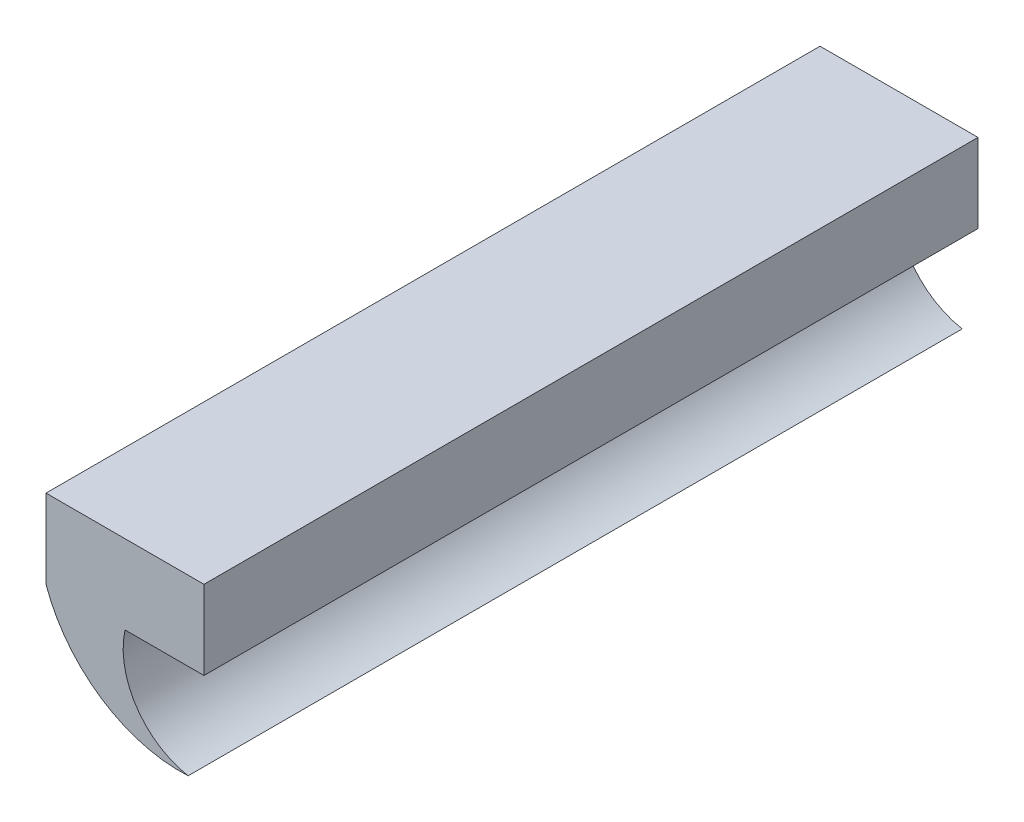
SolidWorks part; units mm, degrees
ref_plane "前视基准面" through (0, 0, 0) normal (0, 0, 1) x (1, 0, 0)
ref_plane "上视基准面" through (0, 0, 0) normal (0, 1, 0) x (1, 0, 0)
ref_plane "右视基准面" through (0, 0, 0) normal (1, 0, 0) x (0, 0, -1)
other "Configuration Table"
sketch "草图1" plane through (0, 0, 0) normal (0, 0, 1) x (1, 0, 0)
  line L1 (0, 1) -> (2, 1)
  line L2 (0, 1) -> (0, 0)
  line L3 (0, 0) -> (2, 0)
  line L4 (2, 1) -> (2, 0)
  dimension "D1" = 1
  dimension "D2" = 2
extrude "凸台-拉伸1" add sketch "草图1" along normal blind 9.8
sketch "草图2" plane through (0, 0, 0) normal (0, 0, -1) x (-1, 0, 0)
  line L13 (0, 0) -> (-2, 0) construction
  line L14 (0, 0) -> (-1, 0)
  line L15 (-2, 0) -> (-2, 1) construction
  arc A0 (0, 0) -> (-1.8, -1.2) centre (-1.6981, 0.5971) cw
  arc A1 (-1.8, -1.2) -> (-1, 0) centre (-1.9765, -0.2157) ccw
  dimension "D1" = 1.8
  dimension "D2" = 1
  dimension "D3" = 1
  dimension "D4" = 1.2
  dimension "D5" = 0.2
extrude "凸台-拉伸2" add sketch "草图2" against normal up to surface (9.8 mm away)
